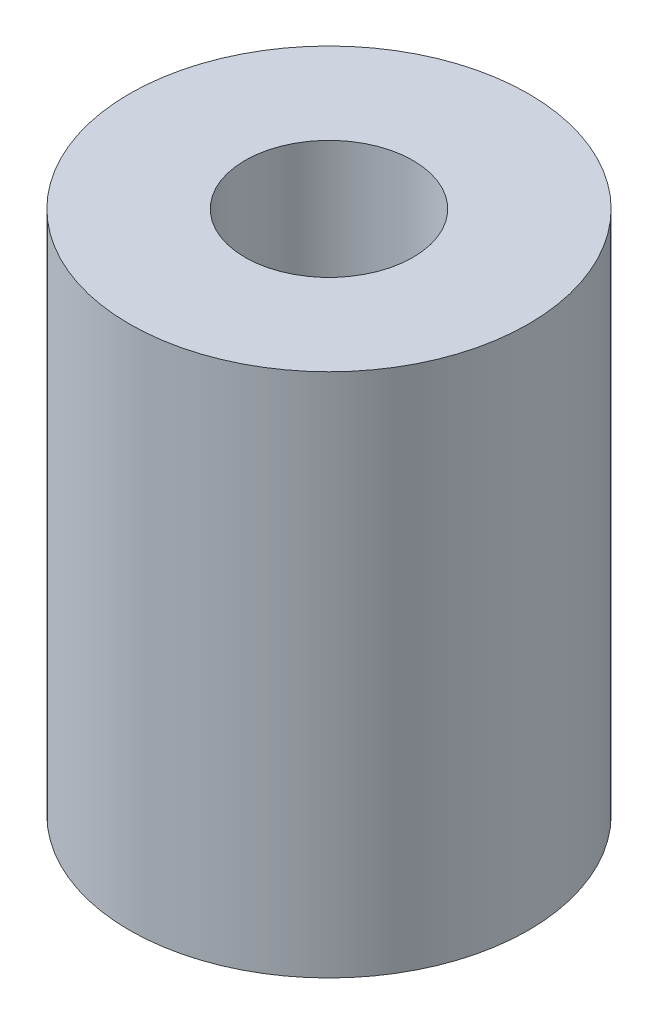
SolidWorks part; units mm, degrees
ref_plane "Front Plane" through (0, 0, 0) normal (0, 0, 1) x (1, 0, 0)
ref_plane "Top Plane" through (0, 0, 0) normal (0, 1, 0) x (1, 0, 0)
ref_plane "Right Plane" through (0, 0, 0) normal (1, 0, 0) x (0, 0, -1)
sketch "Sketch1" plane through (0, 0, 0) normal (0, 1, 0) x (1, 0, 0)
  circle A0 centre (0, 0) radius 2.5
  circle A1 centre (0, 0) radius 9.5
extrude "Boss-Extrude1" add sketch "Sketch1" along normal blind 25
sketch "Sketch2" plane through (0, 25, 0) normal (0, 1, 0) x (1, 0, 0)
  circle A0 centre (0, 0) radius 4
extrude "Cut-Extrude1" cut sketch "Sketch2" against normal blind 12.5
